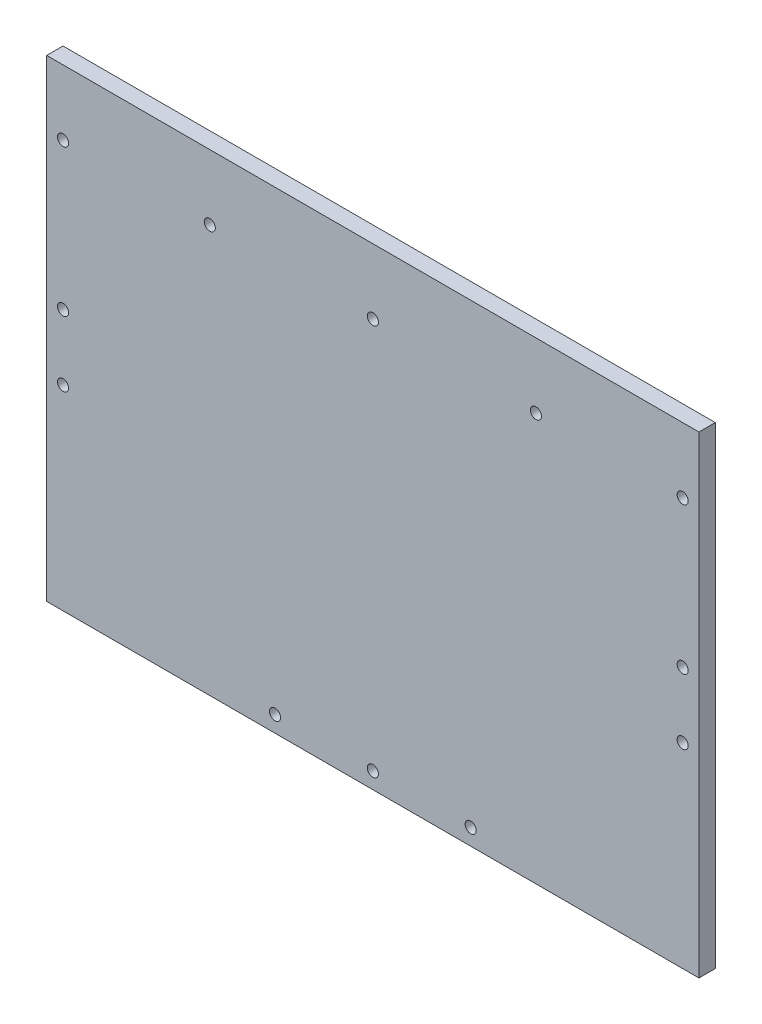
SolidWorks part; units mm, degrees
ref_plane "前视基准面" through (0, 0, 0) normal (0, 0, 1) x (1, 0, 0)
ref_plane "上视基准面" through (0, 0, 0) normal (0, 1, 0) x (1, 0, 0)
ref_plane "右视基准面" through (0, 0, 0) normal (1, 0, 0) x (0, 0, -1)
other "Configuration Table"
sketch "草图1" plane through (0, 0, 0) normal (0, 0, 1) x (1, 0, 0)
  line L1 (-100, 72.5) -> (100, 72.5)
  line L2 (-100, 72.5) -> (-100, -72.5)
  line L3 (-100, -72.5) -> (100, -72.5)
  line L4 (100, 72.5) -> (100, -72.5)
  line L5 (-100, 72.5) -> (100, -72.5) construction
  line L6 (-100, -72.5) -> (100, 72.5) construction
  point P0 (0, 0)
  dimension "D1" = 200
  dimension "D2" = 145
extrude "凸台-拉伸1" add sketch "草图1" along normal blind 5
hole_wizard "M3 十字槽沉头木螺钉的锥形沉头孔1" positions "草图2" profile "草图3" countersink size "M3" standard "GB"
sketch "草图2" plane through (0, 0, 0) normal (0, 0, -1) x (-1, 0, 0)
  line L0 (-100, 72.5) -> (100, 72.5) construction
  line L1 (-100, -72.5) -> (-100, 72.5) construction
  line L2 (100, 72.5) -> (100, -72.5) construction
  point P0 (-95, 52.5)
  point P2 (-50, 52.5)
  point P4 (50, 52.5)
  point P6 (95, 52.5)
  point P11 (0, 52.5)
  dimension "D1" = 20
  dimension "D2" = 20
  dimension "D3" = 20
  dimension "D4" = 20
  dimension "D5" = 20
  dimension "D6" = 5
  dimension "D7" = 5
  dimension "D8" = 100
  dimension "D9" = 50
  dimension "D10" = 50
sketch "草图3" plane through (95, 52.5, 0) normal (1, 0, 0) x (0, 1, 0)
  line L0 (0, 0) -> (0, 15.0215)
  line L1 (0, 15.0215) -> (1.7, 14)
  line L2 (1.7, 14) -> (1.7, 1.6)
  line L3 (1.7, 1.6) -> (3.3, 0)
  line L5 (3.3, 0) -> (0, 0)
  line L6 (-1.7, 1.6) -> (-3.3, 0) construction
  line L10 (0, 15.0215) -> (-1.7, 14) construction
  line L11 (0, -6.35) -> (0, 107.95) construction
  dimension "孔直径" = 3.4
  dimension "孔深度" = 14
  dimension "近端锥形沉头孔直径" = 6.6
  dimension "近端锥形沉头孔角度" = 90
  dimension "导头角度" = 118
hole_wizard "M3 十字槽沉头木螺钉的锥形沉头孔2" positions "草图4" profile "草图5" countersink size "M3" standard "GB"
sketch "草图4" plane through (0, 0, 0) normal (0, 0, -1) x (-1, 0, 0)
  line L0 (-100, -72.5) -> (-100, 72.5) construction
  line L1 (100, 72.5) -> (100, -72.5) construction
  line L2 (-100, 72.5) -> (100, 72.5) construction
  point P0 (-95, 7.5)
  point P2 (-95, -12.5)
  point P4 (95, 7.5)
  point P6 (95, -12.5)
  dimension "D1" = 5
  dimension "D2" = 5
  dimension "D3" = 5
  dimension "D4" = 5
  dimension "D5" = 65
  dimension "D6" = 20
  dimension "D7" = 65
  dimension "D8" = 20
sketch "草图5" plane through (95, 7.5, 0) normal (1, 0, 0) x (0, 1, 0)
  line L0 (0, 0) -> (0, 15.0215)
  line L1 (0, 15.0215) -> (1.7, 14)
  line L2 (1.7, 14) -> (1.7, 1.6)
  line L3 (1.7, 1.6) -> (3.3, 0)
  line L5 (3.3, 0) -> (0, 0)
  line L6 (-1.7, 1.6) -> (-3.3, 0) construction
  line L10 (0, 15.0215) -> (-1.7, 14) construction
  line L11 (0, -6.35) -> (0, 107.95) construction
  dimension "孔直径" = 3.4
  dimension "孔深度" = 14
  dimension "近端锥形沉头孔直径" = 6.6
  dimension "近端锥形沉头孔角度" = 90
  dimension "导头角度" = 118
hole_wizard "M3 十字槽沉头木螺钉的锥形沉头孔3" positions "草图7" profile "草图8" countersink size "M3" standard "GB"
sketch "草图7" plane through (0, 0, 0) normal (0, 0, -1) x (-1, 0, 0)
  line L0 (100, -72.5) -> (-100, -72.5) construction
  line L1 (-100, -72.5) -> (-100, 72.5) construction
  point P0 (-30, -67.5)
  point P2 (0, -67.5)
  point P4 (30, -67.5)
  dimension "D1" = 5
  dimension "D2" = 5
  dimension "D3" = 5
  dimension "D4" = 100
  dimension "D5" = 30
  dimension "D6" = 30
sketch "草图8" plane through (30, -67.5, 0) normal (1, 0, 0) x (0, 1, 0)
  line L0 (0, 0) -> (0, 15.0215)
  line L1 (0, 15.0215) -> (1.7, 14)
  line L2 (1.7, 14) -> (1.7, 1.6)
  line L3 (1.7, 1.6) -> (3.3, 0)
  line L5 (3.3, 0) -> (0, 0)
  line L6 (-1.7, 1.6) -> (-3.3, 0) construction
  line L10 (0, 15.0215) -> (-1.7, 14) construction
  line L11 (0, -6.35) -> (0, 107.95) construction
  dimension "孔直径" = 3.4
  dimension "孔深度" = 14
  dimension "近端锥形沉头孔直径" = 6.6
  dimension "近端锥形沉头孔角度" = 90
  dimension "导头角度" = 118
